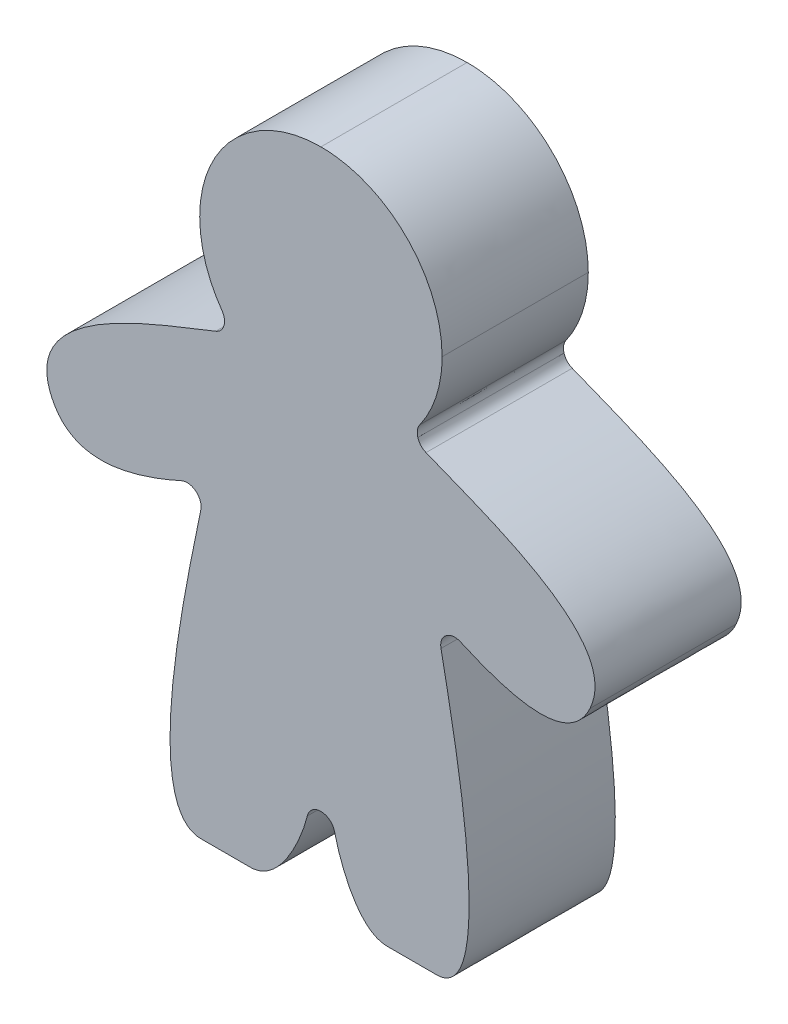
SolidWorks part; units mm, degrees
ref_plane "Front Plane" through (0, 0, 0) normal (0, 0, 1) x (1, 0, 0)
ref_plane "Top Plane" through (0, 0, 0) normal (0, 1, 0) x (1, 0, 0)
ref_plane "Right Plane" through (0, 0, 0) normal (1, 0, 0) x (0, 0, -1)
sketch "Sketch1" plane through (0, 0, 0) normal (0, 0, 1) x (1, 0, 0)
  line L0 (385.5758, 251.4927) -> (382.8854, 251.4927)
  spline S0 degree 3 poles (382.8854, 251.4927) (381.2547, 251.4927) (380.2969, 254.2133) (380.0006, 255.4797) knots 0.04 0.04 0.04 0.04 0.08 0.08 0.08 0.08
  spline S1 degree 3 poles (380.0006, 255.4797) (379.9186, 255.8302) (379.6144, 256.0718) (379.2539, 256.0718) knots 0.08 0.08 0.08 0.08 0.12 0.12 0.12 0.12
  spline S2 degree 3 poles (379.2539, 256.0718) (378.8933, 256.0717) (378.5893, 255.8301) (378.5073, 255.4797) knots 0.12 0.12 0.12 0.12 0.16 0.16 0.16 0.16
  spline S3 degree 3 poles (378.5073, 255.4797) (378.211, 254.2133) (377.023, 251.4927) (375.3923, 251.4927) knots 0.16 0.16 0.16 0.16 0.2 0.2 0.2 0.2
  spline S4 degree 2 poles (375.3923, 251.4927) (375.3923, 251.4927) (372.702, 251.4927) knots 0.2 0.2 0.2 0.24 0.24 0.24
  spline S5 degree 3 poles (372.702, 251.4927) (369.1593, 251.4927) (372.1545, 264.3521) (372.6825, 267.0796) knots 0.24 0.24 0.24 0.24 0.28 0.28 0.28 0.28
  spline S6 degree 3 poles (372.6825, 267.0796) (372.7382, 267.3679) (372.6359, 267.6442) (372.4056, 267.8266) knots 0.28 0.28 0.28 0.28 0.32 0.32 0.32 0.32
  spline S7 degree 3 poles (372.4056, 267.8266) (372.1754, 268.0089) (371.883, 268.0453) (371.6151, 267.9249) knots 0.32 0.32 0.32 0.32 0.36 0.36 0.36 0.36
  spline S8 degree 3 poles (371.6151, 267.9249) (368.682, 266.6072) (365.6647, 265.8803) (364.5327, 268.3081) knots 0.36 0.36 0.36 0.36 0.4 0.4 0.4 0.4
  spline S9 degree 3 poles (364.5327, 268.3081) (362.7603, 272.1089) (369.8808, 274.4793) (373.5015, 275.9536) knots 0.4 0.4 0.4 0.4 0.44 0.44 0.44 0.44
  spline S10 degree 3 poles (373.5015, 275.9536) (373.7257, 276.045) (373.8805, 276.2168) (373.9483, 276.4492) knots 0.44 0.44 0.44 0.44 0.48 0.48 0.48 0.48
  spline S11 degree 3 poles (373.9483, 276.4492) (374.0162, 276.6816) (373.9779, 276.9098) (373.838, 277.1073) knots 0.48 0.48 0.48 0.48 0.52 0.52 0.52 0.52
  spline S12 degree 3 poles (373.838, 277.1073) (373.072, 278.1888) (372.6219, 279.5098) (372.6219, 280.9359) knots 0.52 0.52 0.52 0.52 0.56 0.56 0.56 0.56
  spline S13 degree 3 poles (372.6219, 280.9359) (372.6219, 284.5987) (375.5912, 287.5679) (379.2539, 287.5679) knots 0.56 0.56 0.56 0.56 0.6 0.6 0.6 0.6
  spline S14 degree 3 poles (379.2539, 287.5679) (382.9167, 287.5679) (385.886, 284.5987) (385.886, 280.9359) knots 0.6 0.6 0.6 0.6 0.64 0.64 0.64 0.64
  spline S15 degree 3 poles (385.886, 280.9359) (385.886, 279.5098) (385.4358, 278.1888) (384.6699, 277.1073) knots 0.64 0.64 0.64 0.64 0.68 0.68 0.68 0.68
  spline S16 degree 3 poles (384.6699, 277.1073) (384.53, 276.9098) (384.4918, 276.6816) (384.5596, 276.4492) knots 0.68 0.68 0.68 0.68 0.72 0.72 0.72 0.72
  spline S17 degree 3 poles (384.5596, 276.4492) (384.6274, 276.2169) (384.7823, 276.0451) (385.0064, 275.9537) knots 0.72 0.72 0.72 0.72 0.76 0.76 0.76 0.76
  spline S18 degree 3 poles (385.0064, 275.9537) (388.627, 274.4793) (395.7476, 272.1089) (393.9752, 268.308) knots 0.76 0.76 0.76 0.76 0.8 0.8 0.8 0.8
  spline S19 degree 3 poles (393.9752, 268.308) (392.8432, 265.8803) (389.8259, 266.6072) (386.8929, 267.9248) knots 0.8 0.8 0.8 0.8 0.84 0.84 0.84 0.84
  spline S20 degree 3 poles (386.8929, 267.9248) (386.625, 268.0452) (386.3326, 268.0088) (386.1023, 267.8265) knots 0.84 0.84 0.84 0.84 0.88 0.88 0.88 0.88
  spline S21 degree 3 poles (386.1023, 267.8265) (385.8721, 267.6441) (385.7698, 267.3678) (385.8255, 267.0795) knots 0.88 0.88 0.88 0.88 0.92 0.92 0.92 0.92
  spline S22 degree 3 poles (385.8255, 267.0795) (386.4998, 263.5959) (389.0588, 251.4927) (385.5758, 251.4927) knots 0.92 0.92 0.92 0.92 1 1 1 1
extrude "Boss-Extrude1" add sketch "Sketch1" along normal blind 8
